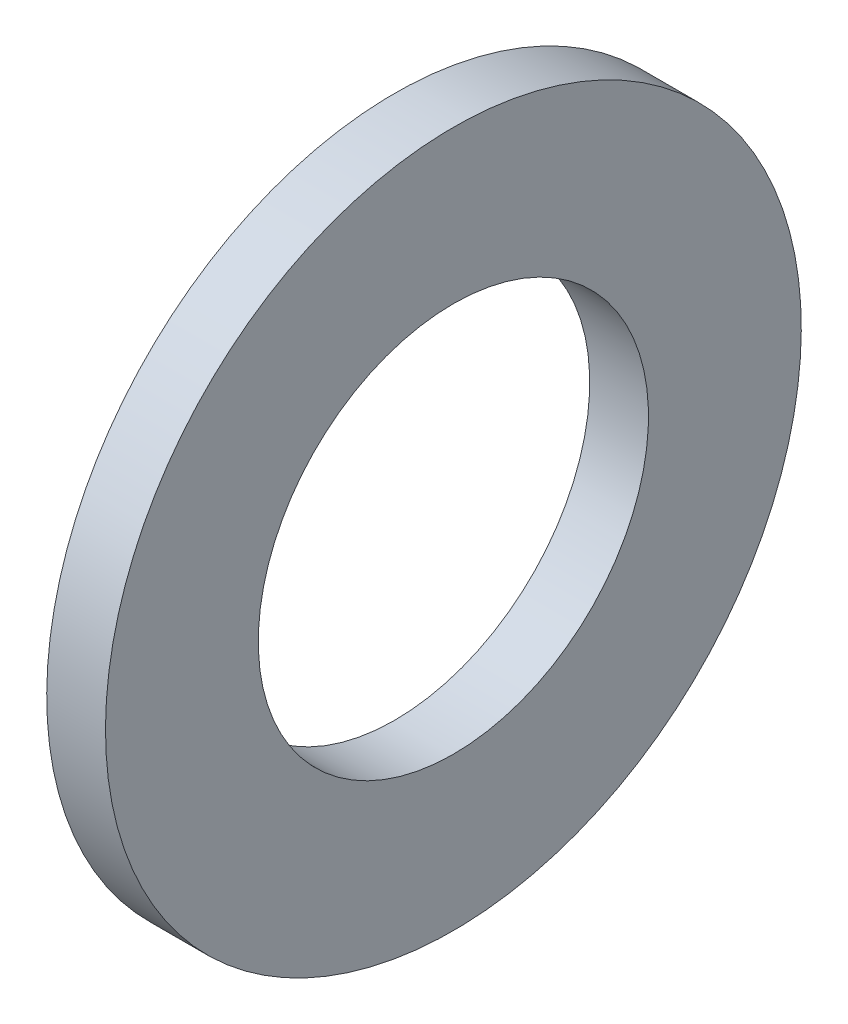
SolidWorks part; units mm, degrees
ref_plane "Front Plane" through (0, 0, 0) normal (0, 0, 1) x (1, 0, 0)
ref_plane "Top Plane" through (0, 0, 0) normal (0, 1, 0) x (1, 0, 0)
ref_plane "Right Plane" through (0, 0, 0) normal (1, 0, 0) x (0, 0, -1)
inserted part "Assem1<1>@Mudd III Small Assembly/Part 4<6>@Assem1"
